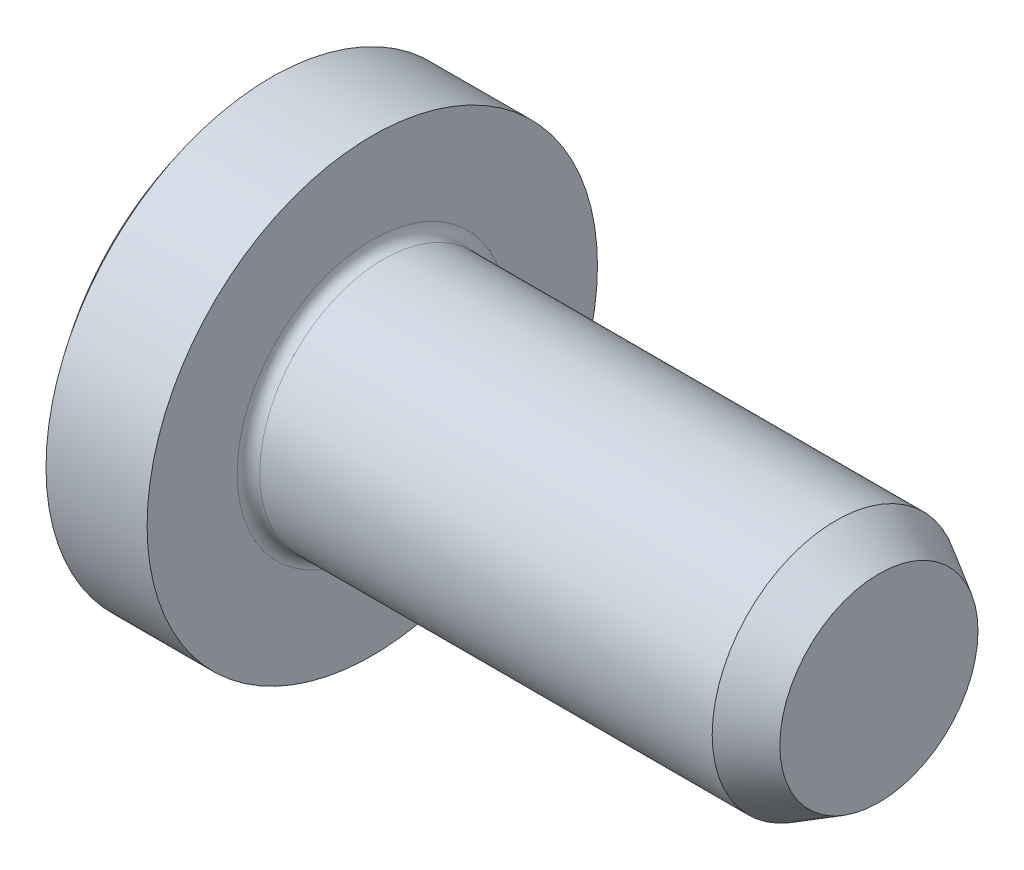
SolidWorks part; units mm, degrees
ref_plane "Front Plane" through (0, 0, 0) normal (0, 0, 1) x (1, 0, 0)
ref_plane "Top Plane" through (0, 0, 0) normal (0, 1, 0) x (1, 0, 0)
ref_plane "Right Plane" through (0, 0, 0) normal (1, 0, 0) x (0, 0, -1)
sketch "Sketch1" plane through (0, 0, 0) normal (0, 0, 1) x (1, 0, 0)
  line L0 (0, 0) -> (5.2282, 0) construction
  line L2 (0, 2) -> (-0.898, 2)
  line L3 (-1.6, 0) -> (-1.6, -0.7496) construction
  line L4 (-1.6, 0) -> (4.5, 0)
  line L5 (0, 1.1) -> (4.5, 1.1)
  line L6 (4.5, 1.1) -> (4.5, 0)
  line L7 (0, 1.1) -> (0, 2)
  arc A0 (-0.898, 2) -> (-1.6, 0) centre (1.6, 0) ccw
  dimension "rf" = 3.2
  dimension "Dk" = 4
  dimension "K" = 1.6
  dimension "l" = 4.5
  dimension "d" = 2.2
revolve "Revolve1" add sketch "Sketch1" angle 360 about L0
chamfer "Chamfer1" distance 0.22 angle 60 1 edges at (4.5, 0, 1.1)
sketch "Sketch5" plane through (0, 0, 0) normal (0, 0, 1) x (1, 0, 0)
  line L0 (0.3703, 0.825) -> (0.2069, 0.825)
  line L1 (0.2069, 0.825) -> (0.0481, 1.1)
  line L2 (0.3703, 0.825) -> (0.529, 1.1)
  line L3 (0.0481, 1.1) -> (0.0481, 1.35)
  line L4 (0.529, 1.1) -> (0.529, 1.35)
  line L5 (0.0481, 1.35) -> (0.529, 1.35)
  line L6 (0.2886, 0.825) -> (0.2886, 0) construction
  line L7 (0, 0) -> (7.3035, 0) construction
  line L9 (4.1189, 1.1) -> (0, 1.1) construction
  line L12 (0, -1.1) -> (0, 1.1) construction
  dimension "D2" = 60
  dimension "D3" = 0.25
  dimension "threadstart" = 0.2886
  dimension "minordia" = 1.65
  dimension "advance" = 0.4809
revolve "ThreadSchematic" [suppressed] cut sketch "Sketch5" angle 360 about L7
pattern_linear "ThdSchPat" [suppressed] count 10 spacing 0.4809 along (1, 0, 0)
sketch "Sketch2" plane through (0, 0, 0) normal (0, 0, 1) x (1, 0, 0)
  line L0 (0, 0) -> (5.7679, 0) construction
  line L1 (4.5, 0) -> (2.5947, 1.1)
  line L3 (4.5, 1.1) -> (4.5, 0) construction
  line L4 (2.5947, 1.1) -> (2.5947, 1.2)
  line L5 (2.5947, 1.2) -> (4.6, 1.2)
  line L6 (4.6, 1.2) -> (4.6, 0)
  line L7 (4.6, 0) -> (4.5, 0)
  point P9 (0, 1.1)
  dimension "D1" = 30
  dimension "D2" = 0.1
  dimension "D3" = 0.1
revolve "EndCone" [suppressed] cut sketch "Sketch2" angle 360 about L0
ref_plane "Plane4" through (-1.6, 0, 0) normal (1, 0, 0) x (0, 0, -1)
sketch "Sketch3" plane through (-1.6, 0, 0) normal (1, 0, 0) x (0, 0, -1)
  line L0 (0, 2.343) -> (0, -2.4842) construction
  line L1 (2.7661, 0) -> (-3.4558, 0) construction
  line L2 (-0.2375, 0.95) -> (0.2375, 0.95)
  line L3 (0.2375, 0.95) -> (0.1425, 0.57)
  line L4 (0, 0) -> (1.9578, 1.9578) construction
  line L5 (0.1425, 0.57) -> (0.299, 0.299)
  line L6 (0.1425, 0.57) -> (0, 0) construction
  line L7 (-0.1425, 0.57) -> (-0.299, 0.299)
  line L8 (-0.2375, 0.95) -> (-0.1425, 0.57)
  line L9 (0.95, 0.2375) -> (0.95, -0.2375)
  line L10 (0.95, -0.2375) -> (0.57, -0.1425)
  line L11 (0.57, -0.1425) -> (0.299, -0.299)
  line L12 (0.57, 0.1425) -> (0.299, 0.299)
  line L13 (0.95, 0.2375) -> (0.57, 0.1425)
  line L14 (0.2375, -0.95) -> (-0.2375, -0.95)
  line L15 (-0.2375, -0.95) -> (-0.1425, -0.57)
  line L16 (-0.1425, -0.57) -> (-0.299, -0.299)
  line L17 (0.1425, -0.57) -> (0.299, -0.299)
  line L18 (0.2375, -0.95) -> (0.1425, -0.57)
  line L19 (-0.95, -0.2375) -> (-0.95, 0.2375)
  line L20 (-0.95, 0.2375) -> (-0.57, 0.1425)
  line L21 (-0.57, 0.1425) -> (-0.299, 0.299)
  line L22 (-0.57, -0.1425) -> (-0.299, -0.299)
  line L23 (-0.95, -0.2375) -> (-0.57, -0.1425)
  point P14 (0, 0.95)
  point P23 (0.95, 0)
  point P30 (0, -0.95)
  point P37 (-0.95, 0)
  dimension "D1" = 45
  dimension "m" = 1.9
  dimension "D3" = 0.475
  dimension "D4" = 75
  dimension "D5" = 1.14
extrude "Cut-Extrude1" cut sketch "Sketch3" along normal blind 0.8 draft 6
sketch "Sketch4" plane through (-1.6, 0, 0) normal (1, 0, 0) x (0, 0, -1)
  line L0 (0, 2.1951) -> (0, -2.1951) construction
  line L1 (2.1996, 0) -> (-2.3835, 0) construction
  line L2 (-0.8397, -0.8397) -> (0.8397, 0.8397) construction
  line L3 (0.95, 0.2375) -> (-0.95, 0.2375)
  line L4 (0.95, 0.2375) -> (0.95, -0.2375)
  line L5 (0.95, -0.2375) -> (-0.95, -0.2375)
  line L6 (-0.95, 0.2375) -> (-0.95, -0.2375)
  line L7 (0.2375, 0.95) -> (-0.2375, 0.95)
  line L8 (0.2375, 0.95) -> (0.2375, -0.95)
  line L9 (0.2375, -0.95) -> (-0.2375, -0.95)
  line L10 (-0.2375, 0.95) -> (-0.2375, -0.95)
  line L11 (0.8397, 0.8397) -> (0.3859, 0.2375)
  line L12 (0.8397, 0.8397) -> (0.2375, 0.3859)
  line L13 (0.2375, 0.3859) -> (-0.2375, 0.3859) construction
  line L14 (0, 0) -> (-0.8397, 0.8397) construction
  line L15 (-0.8397, -0.8397) -> (-0.2375, -0.3859)
  line L16 (-0.8397, -0.8397) -> (-0.3859, -0.2375)
  line L17 (-0.2375, 0.3859) -> (-0.8397, 0.8397)
  line L18 (-0.8397, 0.8397) -> (-0.3859, 0.2375)
  line L19 (-0.3859, -0.2375) -> (-0.3859, 0.2375) construction
  line L20 (0.3859, -0.2375) -> (0.8397, -0.8397)
  line L21 (0.8397, -0.8397) -> (0.2375, -0.3859)
  circle A0 centre (0, 0) radius 1.1875 construction
  dimension "D1" = 2.375
  dimension "D2" = 0.475
  dimension "m" = 1.9
  dimension "D3" = 45
  dimension "D4" = 8
  dimension "D5" = 45
extrude "TypeZ" [suppressed] cut sketch "Sketch4" along normal blind 0.8
fillet "Fillet1" radius 0.1 1 edges at (0, 0, 1.1)
equation "\"D1@Chamfer1\" = \"d@Sketch1\"/10"
equation "\"D1@ThreadCosmetic\" = \"l@Sketch1\" - \"D1@Chamfer1\""
equation "\"minordia@sketch5\" = \"D2@ThreadCosmetic\""
equation "\"D1@Plane4\" = \"K@Sketch1\""
equation "\"D5@Sketch3\" = \"m@Sketch3\" * 3 / 5"
equation "\"D3@Sketch3\" = \"m@Sketch3\" / 4"
equation "\"m@Sketch4\" = \"m@Sketch3\""
equation "\"D2@Sketch4\" =  \"m@Sketch4\" / 4"
equation "\"D1@TypeZ\" = \"K@Sketch1\" / 2"
equation "\"D1@Sketch4\" = \"m@Sketch4\" * 5 / 4"
equation "\"threadstart@Sketch5\" = \"advance@Sketch5\"*0.6"
equation "\"D1@ThdSchPat\" = int((\"l@Sketch1\"/\"advance@Sketch5\") + 0.8)"
equation "\"D3@ThdSchPat\" = \"advance@Sketch5\""
